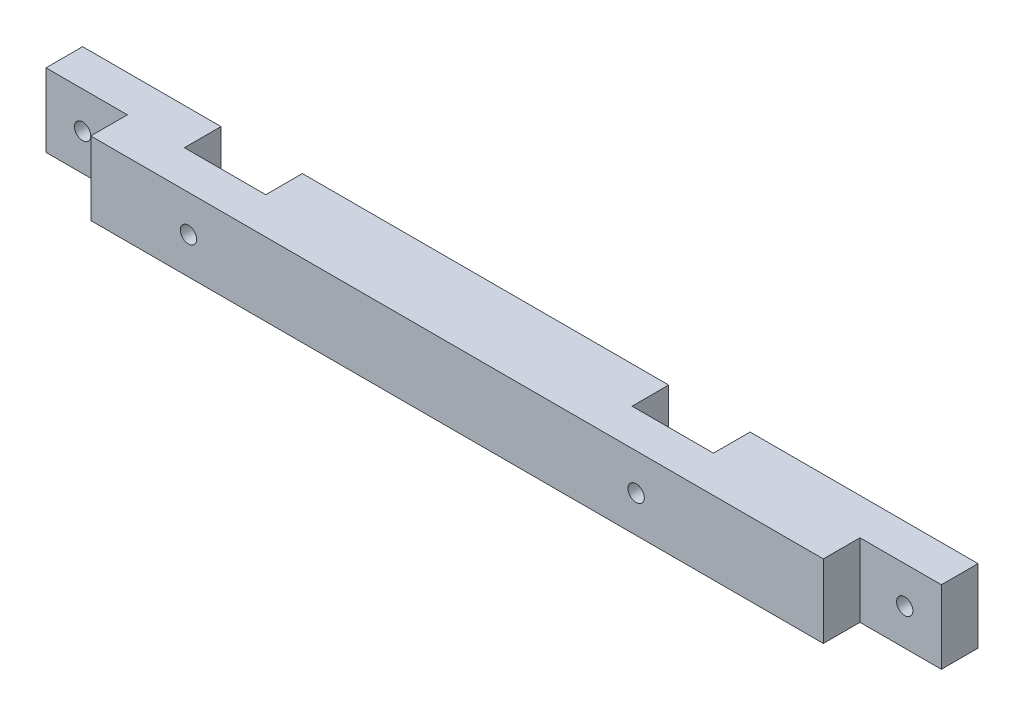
SolidWorks part; units mm, degrees
ref_plane "Face" through (0, 0, 0) normal (0, 0, 1) x (1, 0, 0)
ref_plane "Dessus" through (0, 0, 0) normal (0, 1, 0) x (1, 0, 0)
ref_plane "Droite" through (0, 0, 0) normal (1, 0, 0) x (0, 0, -1)
sketch "Esquisse1" plane through (0, 0, 0) normal (0, 0, 1) x (1, 0, 0)
  line L1 (-67.2717, -109.6176) -> (42.7283, -109.6176)
  line L2 (-67.2717, -109.6176) -> (-67.2717, -100.6176)
  line L3 (-67.2717, -100.6176) -> (42.7283, -100.6176)
  line L4 (42.7283, -109.6176) -> (42.7283, -100.6176)
  dimension "D1" = 110
  dimension "D2" = 9
extrude "Extrusion1" add sketch "Esquisse1" along normal blind 9
sketch "Esquisse2" plane through (0, 0, 9) normal (0, 0, 1) x (1, 0, 0)
  line L0 (42.7283, -100.6176) -> (-67.2717, -100.6176) construction
  line L1 (-67.2717, -109.6176) -> (-57.2717, -109.6176)
  line L2 (-67.2717, -109.6176) -> (-67.2717, -100.6176)
  line L3 (-67.2717, -100.6176) -> (-57.2717, -100.6176)
  line L4 (-57.2717, -109.6176) -> (-57.2717, -100.6176)
  line L6 (42.7283, -109.6176) -> (32.7283, -109.6176)
  line L7 (42.7283, -109.6176) -> (42.7283, -100.6176)
  line L8 (42.7283, -100.6176) -> (32.7283, -100.6176)
  line L9 (32.7283, -109.6176) -> (32.7283, -100.6176)
  dimension "D1" = 10
  dimension "D2" = 10
extrude "Enlèv. mat.-Extru.1" cut sketch "Esquisse2" against normal blind 4.5
sketch "Esquisse4" plane through (0, 0, 4.5) normal (0, 0, 1) x (1, 0, 0)
  line L0 (42.7283, -109.6176) -> (42.7283, -100.6176) construction
  line L1 (32.7283, -109.6176) -> (42.7283, -109.6176) construction
  circle A0 centre (38.2284, -105.1454) radius 1
  point P2 (42.7283, -105.1176)
  point P5 (37.7283, -109.6176)
  dimension "D3" = 2
  dimension "D1" = 4.5
  dimension "D2" = 4.5
extrude "Enlèv. mat.-Extru.2" cut sketch "Esquisse4" against normal blind 4.5
sketch "Esquisse5" plane through (0, 0, 4.5) normal (0, 0, 1) x (1, 0, 0)
  line L0 (-67.2717, -109.6176) -> (-57.2717, -109.6176) construction
  line L1 (-67.2717, -100.6176) -> (-67.2717, -109.6176) construction
  circle A0 centre (-62.7717, -105.1176) radius 1
  dimension "D1" = 2
  dimension "D2" = 4.5
  dimension "D3" = 4.5
extrude "Enlèv. mat.-Extru.3" cut sketch "Esquisse5" against normal blind 4.5
sketch "Esquisse6" plane through (0, 0, 0) normal (0, 0, -1) x (-1, 0, 0)
  line L0 (-42.7283, -100.6176) -> (67.2717, -100.6176) construction
  line L1 (40.2717, -100.6176) -> (50.2717, -100.6176)
  line L2 (40.2717, -100.6176) -> (40.2717, -109.6176)
  line L3 (40.2717, -109.6176) -> (50.2717, -109.6176)
  line L4 (50.2717, -100.6176) -> (50.2717, -109.6176)
  line L5 (67.2717, -109.6176) -> (-42.7283, -109.6176) construction
  line L7 (-14.7283, -100.6176) -> (-4.7283, -100.6176)
  line L8 (-14.7283, -100.6176) -> (-14.7283, -109.6176)
  line L9 (-14.7283, -109.6176) -> (-4.7283, -109.6176)
  line L10 (-4.7283, -100.6176) -> (-4.7283, -109.6176)
  dimension "D1" = 17
  dimension "D2" = 10
  dimension "D3" = 28
  dimension "D4" = 10
extrude "Enlèv. mat.-Extru.4" cut sketch "Esquisse6" against normal blind 4.5
sketch "Esquisse7" plane through (0, 0, 4.5) normal (0, 0, -1) x (-1, 0, 0)
  line L0 (50.2717, -100.6176) -> (40.2717, -109.6176) construction
  line L1 (40.2717, -109.6176) -> (40.2717, -100.6176) construction
  line L2 (40.2717, -100.6176) -> (40.2717, -109.6176) construction
  line L3 (40.2717, -100.6176) -> (40.2717, -109.6176) construction
  line L4 (40.2717, -100.6176) -> (50.2717, -109.6176) construction
  line L5 (50.2717, -109.6176) -> (-14.7283, -100.6176) construction
  line L6 (-14.7283, -100.6176) -> (-4.7283, -109.6176) construction
  line L7 (-4.7283, -109.6176) -> (-4.7283, -100.6176) construction
  line L8 (-4.7283, -100.6176) -> (-14.7283, -109.6176) construction
  circle A0 centre (45.2717, -105.1176) radius 1
  circle A1 centre (-9.7283, -105.1176) radius 1
  dimension "D1" = 2
  dimension "D2" = 2
extrude "Enlèv. mat.-Extru.5" cut sketch "Esquisse7" against normal blind 4.5
